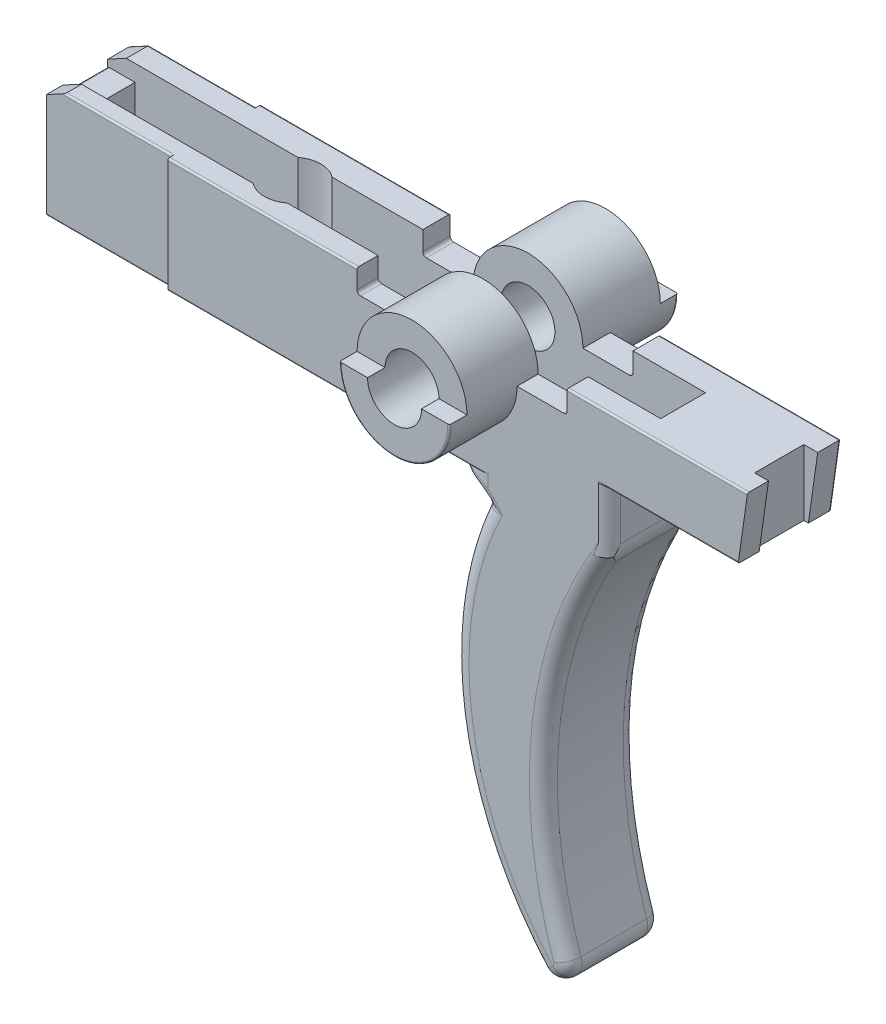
SolidWorks part; units mm, degrees
ref_plane "Front Plane" through (0, 0, 0) normal (0, 0, 1) x (1, 0, 0)
ref_plane "Top Plane" through (0, 0, 0) normal (0, 1, 0) x (1, 0, 0)
ref_plane "Right Plane" through (0, 0, 0) normal (1, 0, 0) x (0, 0, -1)
sketch "Sketch1" plane through (0, 0, 0) normal (1, 0, 0) x (0, 0, -1)
  line L1 (0, 0) -> (-6.7564, 0)
  line L2 (0, 0) -> (0, 8.3312)
  line L3 (0, 8.3312) -> (-6.7564, 8.3312)
  line L4 (-6.7564, 0) -> (-6.7564, 8.3312)
  dimension "D1" = 6.7564
  dimension "D2" = 8.3312
extrude "Boss-Extrude1" add sketch "Sketch1" along normal blind 51.181
sketch "Sketch2" plane through (0, 0, 6.7564) normal (0, 0, 1) x (1, 0, 0)
  line L0 (0, 8.3312) -> (0, 0) construction
  line L1 (51.181, 8.3312) -> (0, 8.3312) construction
  circle A0 centre (30.48, 6.6802) radius 3.9878
  dimension "D1" = 7.9756
  dimension "D2" = 30.48
  dimension "D3" = 1.651
extrude "Boss-Extrude2" add sketch "Sketch2" along normal mid plane 24.892
sketch "Sketch3" plane through (0, 0, 0) normal (0, 1, 0) x (1, 0, 0)
  line L0 (26.85, 0) -> (0, 0) construction
  line L1 (21.2307, 11.3587) -> (40.4671, 11.3587)
  line L2 (21.2307, 11.3587) -> (21.2307, 4.9022)
  line L3 (21.2307, 4.9022) -> (40.4671, 4.9022)
  line L4 (40.4671, 11.3587) -> (40.4671, 4.9022)
  line L5 (20.6982, -25.1042) -> (41.8649, -25.1042)
  line L6 (20.6982, -25.1042) -> (20.6982, -11.6586)
  line L7 (20.6982, -11.6586) -> (41.8649, -11.6586)
  line L8 (41.8649, -25.1042) -> (41.8649, -11.6586)
  line L9 (26.85, -6.7564) -> (0, -6.7564) construction
  dimension "D1" = 4.9022
  dimension "D2" = 4.9022
extrude "Cut-Extrude1" cut sketch "Sketch3" along normal blind 24.892
sketch "Sketch4" plane through (0, 0, 11.6586) normal (0, 0, 1) x (1, 0, 0)
  circle A0 centre (30.48, 6.6802) radius 1.9558
  dimension "D1" = 3.9116
extrude "Cut-Extrude2" cut sketch "Sketch4" against normal blind 24.892
sketch "Sketch5" plane through (0, 0, 0) normal (-1, 0, 0) x (0, 0, 1)
  line L0 (0, 6.6802) -> (-4.9022, 6.6802) construction
  line L1 (10.3886, 11.878) -> (13.0868, 11.878)
  line L2 (10.3886, 11.878) -> (10.3886, 6.6986)
  line L3 (10.3886, 6.6986) -> (13.0868, 6.6986)
  line L4 (13.0868, 11.878) -> (13.0868, 6.6986)
  line L5 (-6.4068, 12.1261) -> (-3.6322, 12.1261)
  line L6 (-6.4068, 12.1261) -> (-6.4068, 6.6802)
  line L7 (-6.4068, 6.6802) -> (-3.6322, 6.6802)
  line L8 (-3.6322, 12.1261) -> (-3.6322, 6.6802)
  line L9 (-4.9022, 10.668) -> (-4.9022, 2.6924) construction
  line L10 (11.6586, 2.6924) -> (11.6586, 10.668) construction
  dimension "D1" = 1.27
  dimension "D2" = 1.27
extrude "Cut-Extrude3" cut sketch "Sketch5" against normal blind 45.212
ref_plane "Plane1" through (0, 0, 1.9812) normal (0, 0, 1) x (1, 0, 0)
sketch "Sketch6" plane through (0, 0, 1.9812) normal (0, 0, 1) x (1, 0, 0)
  line L0 (1.9812, 9.1414) -> (1.9812, 2.1844)
  line L1 (1.9812, 2.1844) -> (32.8761, 2.1844)
  line L2 (51.181, 8.3312) -> (34.11, 8.3312) construction
  line L3 (43.3578, 8.3312) -> (25.4843, 17.0489)
  line L4 (25.4843, 17.0489) -> (1.9812, 9.1414)
  line L5 (26.85, 8.3312) -> (0, 8.3312) construction
  line L6 (0, 0) -> (0, 8.3312) construction
  arc A0 (32.8761, 2.1844) -> (43.3578, 8.3312) centre (32.8761, 14.1947) ccw
  dimension "D1" = 6.1468
  dimension "D2" = 7.8232
  dimension "D3" = 1.9812
extrude "Cut-Extrude4" cut sketch "Sketch6" along normal blind 3.2512
sketch "Sketch7" plane through (0, 0, 0) normal (0, 0, -1) x (-1, 0, 0)
  line L0 (-34.0282, 8.5002) -> (-34.4678, 9.9614)
  line L1 (-34.4678, 6.6802) -> (-37.846, 6.6802)
  line L3 (-34.4678, 9.9614) -> (-38.1, 9.9614)
  line L4 (-38.1, 6.9342) -> (-38.1, 9.9614)
  line L5 (-26.4922, 6.6802) -> (-23.114, 6.6802)
  line L7 (-26.4922, 10.6084) -> (-22.86, 10.6084)
  line L8 (-22.86, 6.9342) -> (-22.86, 10.6084)
  line L9 (-26.9318, 8.5002) -> (-26.4922, 10.6084)
  arc A0 (-34.4678, 6.6802) -> (-34.0282, 8.5002) centre (-30.48, 6.6802) cw
  arc A1 (-26.4922, 6.6802) -> (-34.4678, 6.6802) centre (-30.48, 6.6802) ccw construction
  arc A2 (-26.4922, 6.6802) -> (-26.9318, 8.5002) centre (-30.48, 6.6802) ccw
  arc A3 (-23.114, 6.6802) -> (-22.86, 6.9342) centre (-23.114, 6.9342) ccw
  arc A4 (-37.846, 6.6802) -> (-38.1, 6.9342) centre (-37.846, 6.9342) cw
  dimension "D1" = 3.6322
  dimension "D3" = 0.254
  dimension "D2" = 3.6322
extrude "Cut-Extrude5" cut sketch "Sketch7" against normal blind 13.4112
sketch "Sketch8" plane through (0, 0, 0) normal (0, 0, -1) x (-1, 0, 0)
  line L0 (-51.7827, 3.556) -> (-43.7642, 3.556)
  line L1 (-43.7642, 3.556) -> (-43.7642, -1.7024)
  line L2 (-43.7642, -1.7024) -> (-51.7827, -1.7024)
  line L3 (-51.7827, -1.7024) -> (-51.7827, 3.556)
  line L4 (-51.181, 8.3312) -> (-38.1, 8.3312) construction
  line L5 (-51.181, 0) -> (-51.181, 8.3312) construction
  dimension "D1" = 4.7752
  dimension "D2" = 7.4168
extrude "Cut-Extrude6" cut sketch "Sketch8" against normal blind 13.4112
sketch "Sketch9" plane through (0, 0, 0) normal (0, -1, 0) x (1, 0, 0)
  line L0 (40.3606, 3.3528) -> (32.3596, 3.3528) construction
  line L1 (40.3606, -0.0508) -> (32.3596, -0.0508)
  line L2 (40.3606, 6.7564) -> (32.3596, 6.7564)
  line L3 (43.7642, 0) -> (43.7642, 6.7564) construction
  line L4 (43.7642, 6.7564) -> (0, 6.7564) construction
  arc A0 (40.3606, -0.0508) -> (40.3606, 6.7564) centre (40.3606, 3.3528) ccw
  arc A1 (32.3596, 6.7564) -> (32.3596, -0.0508) centre (32.3596, 3.3528) ccw
  point P2 (36.3601, 3.3528)
  dimension "D1" = 8.001
  dimension "D2" = 6.8072
extrude "Boss-Extrude3" add sketch "Sketch9" along normal blind 2.54
sketch "Sketch11" plane through (0, -2.54, 0) normal (0, -1, 0) x (1, 0, 0)
  line L0 (43.7642, 0) -> (51.181, 0) construction
  line L1 (40.3606, 6.7564) -> (45.5987, 6.7564)
  line L3 (40.9465, 0) -> (45.5987, 0)
  line L4 (45.5987, 6.7564) -> (45.5987, 0)
  arc A0 (40.9465, 0) -> (40.3606, 6.7564) centre (40.3606, 3.3528) ccw
extrude "Cut-Extrude7" cut sketch "Sketch11" against normal up to surface (6.096 mm away)
sketch "Sketch12" plane through (0, 8.3312, 0) normal (0, 1, 0) x (1, 0, 0)
  line L0 (0, -3.3782) -> (21.0975, -3.3782) construction
  line L1 (0, 0) -> (0, -6.7564) construction
  line L2 (22.86, 0) -> (0, 0) construction
  line L3 (-2.8648, 5.0613) -> (9.144, 5.0613)
  line L4 (-2.8648, 5.0613) -> (-2.8648, -0.3302)
  line L5 (-2.8648, -0.3302) -> (9.144, -0.3302)
  line L6 (9.144, 5.0613) -> (9.144, -0.3302)
  line L7 (9.144, -11.8177) -> (9.144, -6.4262)
  line L8 (-2.8648, -6.4262) -> (9.144, -6.4262)
  line L9 (-2.8648, -11.8177) -> (-2.8648, -6.4262)
  line L10 (-2.8648, -11.8177) -> (9.144, -11.8177)
  dimension "D1" = 0.3302
  dimension "D2" = 9.144
extrude "Cut-Extrude8" cut sketch "Sketch12" against normal blind 12.065
sketch "Sketch13" plane through (0, 0, 6.4262) normal (0, 0, 1) x (1, 0, 0)
  line L0 (-2.6651, 6.168) -> (2.5267, 8.9636)
  line L1 (2.5267, 8.9636) -> (-0.8679, 10.428)
  line L2 (-0.8679, 10.428) -> (-2.6651, 6.168)
extrude "Cut-Extrude9" cut sketch "Sketch13" against normal blind 12.065
sketch "Sketch14" plane through (0, 0, 0) normal (-1, 0, 0) x (0, 0, 1)
  line L0 (1.9812, 8.3312) -> (1.9812, 2.1844) construction
  line L1 (1.9812, 7.1374) -> (5.2324, 7.1374)
  line L2 (1.9812, 7.1374) -> (1.9812, 10.668)
  line L3 (1.9812, 10.668) -> (5.2324, 10.668)
  line L4 (5.2324, 7.1374) -> (5.2324, 10.668)
  line L5 (0.3302, 8.3312) -> (6.4262, 8.3312) construction
  dimension "D1" = 1.1938
extrude "Cut-Extrude10" cut sketch "Sketch14" against normal blind 12.065
sketch "Sketch15" plane through (0, 8.3312, 0) normal (0, 1, 0) x (1, 0, 0)
  line L0 (0, -1.9812) -> (0, -5.2324) construction
  circle A0 centre (15.0368, -3.6068) radius 2.0447
  dimension "D1" = 15.0368
  dimension "D2" = 4.0894
extrude "Cut-Extrude11" cut sketch "Sketch15" against normal blind 6.858
sketch "Sketch16" plane through (0, 0, 0) normal (0, 0, -1) x (-1, 0, 0)
  line L0 (-51.181, 8.3312) -> (-50.3928, 2.7814)
  line L1 (-50.3928, 2.7814) -> (-53.3995, 3.0478)
  line L2 (-53.3995, 3.0478) -> (-51.181, 8.3312)
extrude "Cut-Extrude12" cut sketch "Sketch16" against normal blind 6.858
sketch "Sketch17" plane through (0, 0, 6.7564) normal (0, 0, 1) x (1, 0, 0)
  line L1 (28.956, -2.54) -> (40.386, -2.54)
  line L2 (28.956, -2.54) -> (28.956, -32.385)
  line L3 (28.956, -32.385) -> (40.386, -32.385)
  line L4 (40.386, -2.54) -> (40.386, -32.385)
extrude "Boss-Extrude4" add sketch "Sketch17" against normal up to surface (6.8072 mm away)
sketch "Sketch18" plane through (0, -32.385, 0) normal (0, -1, 0) x (1, 0, 0)
  line L0 (32.3596, 6.7564) -> (32.4358, 8.4455)
  line L1 (32.4358, 5.2324) -> (32.4358, 11.6586) construction
  line L2 (32.4358, 8.4455) -> (27.0881, 8.4455)
  line L3 (27.0881, 8.4455) -> (27.0881, -1.2811)
  line L4 (27.0881, -1.2811) -> (32.3596, -1.2811)
  line L5 (32.3596, -1.2811) -> (32.3596, -0.0508)
  arc A0 (32.3596, 6.7564) -> (32.3596, -0.0508) centre (32.3596, 3.3528) ccw
extrude "Cut-Extrude13" cut sketch "Sketch18" against normal up to surface (32.385 mm away)
sketch "Sketch19" plane through (0, 0, 6.7564) normal (0, 0, 1) x (1, 0, 0)
  line L0 (43.7642, -2.3622) -> (37.4852, -8.6412)
  line L1 (43.7642, -2.54) -> (43.7642, 3.556) construction
  line L2 (37.4852, -8.6412) -> (37.4852, -29.2447)
  line L6 (41.1931, -32.9526) -> (47.3646, -22.6509)
  line L7 (47.3646, -22.6509) -> (43.7642, -2.3622)
  line L8 (40.3606, 3.556) -> (50.5028, 3.556) construction
  line L9 (37.4852, -29.2447) -> (37.4852, -30.6193)
  line L10 (37.4852, -30.6193) -> (41.1931, -32.9526)
  dimension "D1" = 5.9182
extrude "Cut-Extrude14" cut sketch "Sketch19" against normal blind 6.858
fillet "Fillet3" radius 0.508 6 edges at (36.3253, -32.385, -0.0508) (28.956, -32.385, 3.3528) (36.3253, -32.385, 6.7564) (38.8881, -31.5022, -0.0508) (38.8881, -31.5022, 6.7564) (40.291, -32.385, 3.3528)
fillet "Fillet4" radius 1.27 5 edges at (38.9356, -7.1908, -0.0508) (38.9356, -7.1908, 6.7564) (37.4852, -8.6412, 3.3528) (37.4852, -19.9304, -0.0508) (37.4852, -19.9304, 6.7564)
sketch "Sketch21" plane through (0, 8.3312, 0) normal (0, 1, 0) x (1, 0, 0)
  line L1 (51.8795, -1.6682) -> (50.1736, -1.6682)
  line L2 (51.8795, -1.6682) -> (51.8795, -5.2324)
  line L3 (51.8795, -5.2324) -> (50.1736, -5.2324)
  line L4 (50.1736, -1.6682) -> (50.1736, -5.2324)
extrude "Cut-Extrude16" cut sketch "Sketch21" against normal blind 6.858
fillet "Fillet6" radius 0.127 12 edges at (0, 0, 3.3782) (4.572, 0, 6.4262) (45.4317, 3.556, 6.7564) (50.8419, 5.9436, 0) (45.7246, 3.556, 0) (16.002, 8.3312, 0) (5.2481, 8.3312, 0.3302) (0.6761, 7.9671, 0.3302) (0, 3.8015, 0.3302) (4.572, 0, 0.3302) (20.4589, 0, 0)
fillet "Fillet7" radius 0.127 5 edges at (0, 7.1374, 3.6068) (5.2481, 8.3312, 6.4262) (16.002, 8.3312, 6.7564) (44.5764, 8.3312, 0) (44.6405, 8.3312, 6.7564)
fillet "Fillet8" radius 0.127 2 edges at (30.48, 2.6924, 11.6586) (30.48, 2.6924, -4.9022)
sketch "Sketch22" plane through (0, 0, -0.0508) normal (0, 0, -1) x (-1, 0, 0)
  line L1 (-44.9743, -1.1813) -> (-26.7583, -1.1813)
  line L2 (-44.9743, -1.1813) -> (-44.9743, -33.671)
  line L3 (-44.9743, -33.671) -> (-26.7583, -33.671)
  line L4 (-26.7583, -1.1813) -> (-26.7583, -33.671)
extrude "Cut-Extrude17" cut sketch "Sketch22" against normal blind 15.24
sketch "Sketch23" plane through (0, 0, -0.0508) normal (0, 0, -1) x (-1, 0, 0)
  line L0 (-40.9465, -1.1813) -> (-32.3596, -1.1813)
  arc A0 (-40.9465, -1.1813) -> (-39.2573, -30.7856) centre (-68.0378, -17.5774) cw
  arc A1 (-39.2573, -30.7856) -> (-38.1666, -31.3708) centre (-38.712, -31.0782) ccw
  arc A2 (-32.3596, -1.1813) -> (-38.1666, -31.3708) centre (-55.0561, -12.4688) cw
extrude "Boss-Extrude5" add sketch "Sketch23" against normal up to surface (6.8072 mm away)
fillet "Fillet9" radius 1.016 2 edges at (36.4226, -15.7735, -0.0508) (36.4226, -15.7735, 6.7564)
fillet "Fillet10" radius 1.27 1 edges at (30.1641, -17.2569, -0.0508)
fillet "Fillet11" radius 0.762 4 edges at (32.6181, -1.1813, 6.217) (32.6181, -1.1813, 0.4886) (32.3596, -1.1813, 3.3528) (28.956, -1.1813, 3.3528)
sketch "Sketch24" plane through (0, -1.1813, 0) normal (0, -1, 0) x (1, 0, 0)
  line L1 (40.9465, 5.7404) -> (40.9465, 0.9652)
  line L2 (40.9465, 5.7404) -> (40.9465, 0.9652)
  arc A3 (39.9956, -0.0312) -> (39.9956, 6.7368) centre (40.3606, 3.3528) ccw
  arc A6 (39.9956, -0.0312) -> (39.9956, 6.7368) centre (40.3606, 3.3528) ccw
  spline S2 degree 3 poles (967.5994, 2859.1689) (-156.5671, -436.8563) (22.0796, 15.6029) (40.4618, 6.5675) (40.565, 6.4959) (40.742, 6.3221) (40.8166, 6.2184) (44.5033, -2.0082) (-70.4371, -58.6897) (-1830.5373, 2347.0506) knots -40.490978 -40.490978 -40.490978 -40.490978 0.25 0.25 0.5 0.5 0.75 0.75 18.533313 18.533313 18.533313 18.533313 only from (39.9956, 6.7368) to (40.9465, 5.7404)
  spline S3 degree 3 poles (39.9956, 6.7368) (40.1194, 6.7154) (40.2376, 6.6777) (40.4618, 6.5675) (40.565, 6.4959) (40.742, 6.3221) (40.8166, 6.2184) (40.9188, 5.9903) (40.9465, 5.8667) (40.9465, 5.7404) knots 0 0 0 0 0.25 0.25 0.5 0.5 0.75 0.75 1 1 1 1
  spline S4 degree 3 poles (-1833.8421, -2337.6798) (-72.3279, 65.4723) (44.5182, 8.7768) (40.8174, 0.4886) (40.7434, 0.3852) (40.5664, 0.2108) (40.4621, 0.1384) (31.3621, -4.3462) (-36.7099, 97.2511) (2911.9264, 860.0879) knots -17.709441 -17.709441 -17.709441 -17.709441 0.25 0.25 0.5 0.5 0.75 0.75 20.938654 20.938654 20.938654 20.938654 only from (40.9465, 0.9652) to (39.9956, -0.0312)
  spline S5 degree 3 poles (40.9465, 0.9652) (40.9465, 0.8394) (40.919, 0.7162) (40.8174, 0.4886) (40.7434, 0.3852) (40.5664, 0.2108) (40.4621, 0.1384) (40.2395, 0.0287) (40.1192, -0.0099) (39.9956, -0.0312) knots 0 0 0 0 0.25 0.25 0.5 0.5 0.75 0.75 1 1 1 1
  dimension "D1" = 0
extrude "Cut-Extrude18" cut sketch "Sketch24" against normal up to surface (4.7373 mm away)
fillet "Fillet14" radius 2.54 1 edges
sketch "Sketch25" plane through (0, 0, -0.0508) normal (0, 0, -1) x (-1, 0, 0)
  line L1 (-44.7979, 2.0594) -> (-26.6926, 2.0594)
  line L2 (-44.7979, 2.0594) -> (-44.7979, -31.0025)
  line L3 (-44.7979, -31.0025) -> (-26.6926, -31.0025)
  line L4 (-26.6926, 2.0594) -> (-26.6926, -31.0025)
extrude "Cut-Extrude19" cut sketch "Sketch25" against normal up to surface (0.0508 mm away)
